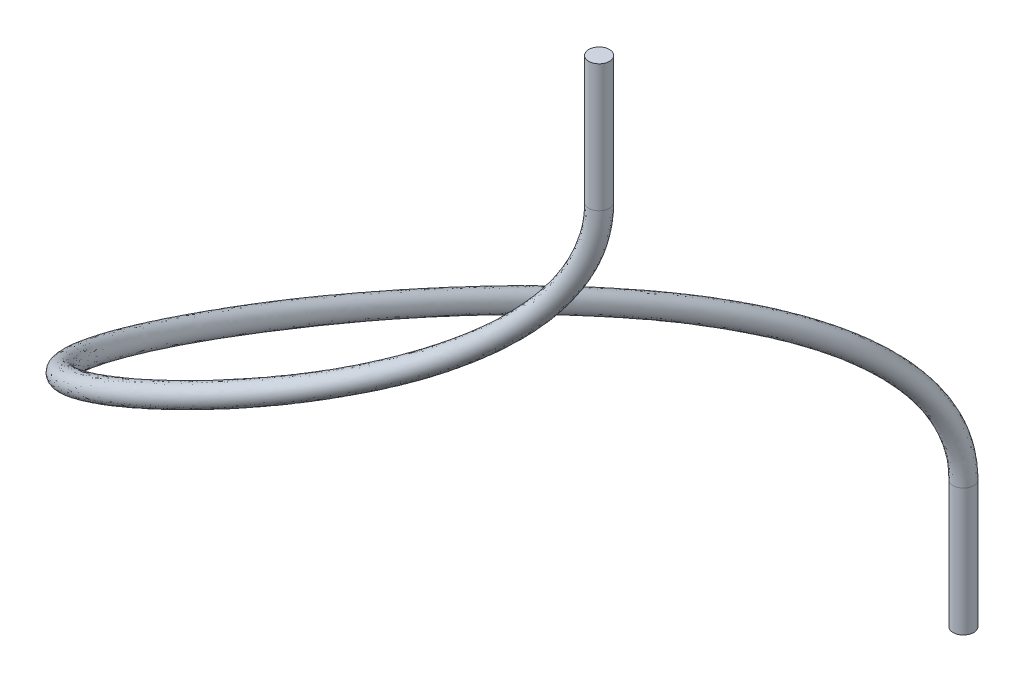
SolidWorks part; units mm, degrees
ref_plane "Front Plane" through (0, 0, 0) normal (0, 0, 1) x (1, 0, 0)
ref_plane "Top Plane" through (0, 0, 0) normal (0, 1, 0) x (1, 0, 0)
ref_plane "Right Plane" through (0, 0, 0) normal (1, 0, 0) x (0, 0, -1)
sketch3d "3DSketch1"
  line L0 (129.032, 71.5645, 13.3985) -> (129.032, 81.5721, 13.3985) construction
  line L1 (161.925, 157.6705, 74.93) -> (161.925, 147.6629, 74.93) construction
  line L2 (129.032, 71.5645, 13.3985) -> (129.032, 81.5721, 13.3985)
  line L3 (161.925, 157.6705, 74.93) -> (161.925, 147.6629, 74.93)
  spline S0 degree 3 poles (-8503.818, -3659.7286, 12942.7135) (1233.1139, 195.0049, -1270.7363) (-1032.9574, -66.7185, 1133.9327) (1290.7046, 375.5621, -742.7857) (-14105.2037, 905.7423, 7251.7979) knots -2.756903 -2.756903 -2.756903 -2.756903 0.565771 3.550902 3.550902 3.550902 3.550902 only from (129.032, 81.5721, 13.3985) to (161.925, 147.6629, 74.93) construction
  spline S1 degree 3 poles (129.032, 81.5721, 13.3985) (129.032, 100.7073, 13.3985) (87.8017, 107.9951, 97.9662) (161.925, 132.9766, 74.93) (161.925, 147.6629, 74.93) knots 0 0 0 0 0.565771 1 1 1 1
ref_plane "Plane1" through (129.032, 71.5645, 13.3985) normal (0, 1, 0) x (-1, 0, 0)
sketch "PipeSketch" plane through (129.032, 71.5645, 13.3985) normal (0, 1, 0) x (-1, 0, 0)
  circle A0 centre (0, 0) radius 0.813
  dimension "OuterDiameter" = 1.626
sweep "Cable_1" add profiles "PipeSketch" path "3DSketch1"
